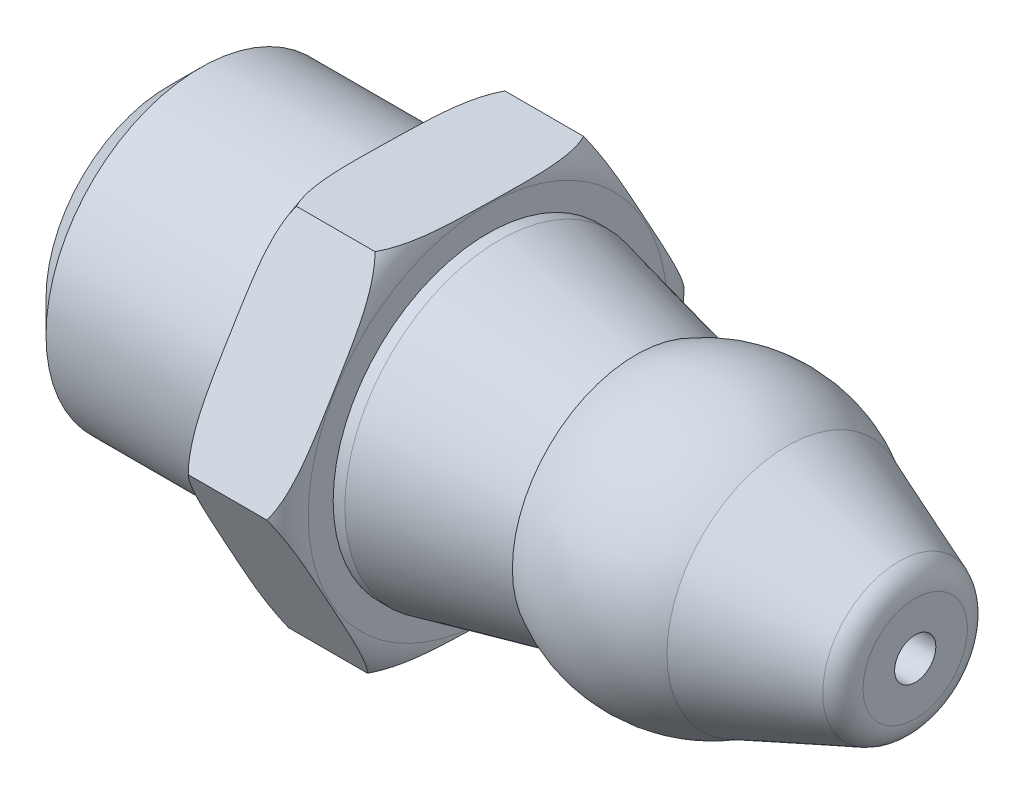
SolidWorks part; units mm, degrees
ref_plane "FACE" through (0, 0, 0) normal (0, 0, 1) x (1, 0, 0)
ref_plane "DESSUS" through (0, 0, 0) normal (0, 1, 0) x (1, 0, 0)
ref_plane "DROITE" through (0, 0, 0) normal (1, 0, 0) x (0, 0, -1)
sketch "Esquisse1" plane through (0, 0, 0) normal (0, 0, 1) x (1, 0, 0)
  line L0 (-14.5, 2.375) -> (-14.5, 0)
  line L1 (-14.5, 0) -> (0, 0)
  line L2 (0, 0) -> (9.8709, 0) construction
  line L7 (-14.5, 2.375) -> (-13.875, 3)
  line L8 (-8.0737, 3) -> (-13.875, 3)
  line L12 (0, 0) -> (0, 1.353)
  line L18 (-2.4883, 2.3311) -> (0, 1.353)
  line L19 (-8.0737, 3) -> (-5.4243, 2.3963)
  arc A6 (-2.4883, 2.3311) -> (-5.4243, 2.3963) centre (-4.0131, -0.1936) ccw
  dimension "D1" = 8.0737
revolve "Base-Révolution" add sketch "Esquisse1" angle 360 about L2
ref_plane "Plan1" through (-8.07, 0, 0) normal (1, 0, 0) x (0, 0, -1)
ref_plane "Plan2" through (-10.3, 0, 0) normal (-1, 0, 0) x (0, 0, 1)
sketch "Hexagon - inscribed1" plane through (-10.3, 0.2447, 0.4635) normal (-1, 0, 0) x (0, 0, 1)
  line L0 (3.5856, -0.159) -> (1.4868, 3.3048)
  line L1 (1.4868, 3.3048) -> (-2.5623, 3.219)
  line L2 (-2.5623, 3.219) -> (-4.5126, -0.3305)
  line L3 (-4.5126, -0.3305) -> (-2.4138, -3.7942)
  line L4 (-2.4138, -3.7942) -> (1.6353, -3.7085)
  line L5 (1.6353, -3.7085) -> (3.5856, -0.159)
  circle A0 centre (-0.4635, -0.2447) radius 4.05 construction
  circle A1 centre (-0.4635, -0.2447) radius 3 construction
  dimension "Outside Diameter" = 8.1
extrude "Boss.-Extru.1" add sketch "Hexagon - inscribed1" against normal blind 2
sketch "Esquisse5" plane through (0, 0, 0) normal (0, 1, 0) x (1, 0, 0)
  line L0 (-8.3, 4.0491) -> (-10.3, 4.0491) construction
  line L1 (-10.3, 4.2826) -> (-9.533, 4.2826)
  line L2 (-10.3, 2.0988) -> (-10.3, 4.0491) construction
  line L3 (-10.3, 3.4833) -> (-10.3, 4.2826)
  line L4 (-9.3, 5.0213) -> (-9.3, 1.4398) construction
  line L5 (-8.3, 3.4833) -> (-8.3, 4.2826)
  line L6 (-9.067, 4.2826) -> (-8.3, 4.2826)
  line L7 (-15.8233, 0) -> (-0.8676, 0) construction
  arc A0 (-10.3, 3.4833) -> (-9.533, 4.2826) centre (-9.5001, 3.4833) cw
  arc A1 (-8.3, 3.4833) -> (-9.067, 4.2826) centre (-9.0999, 3.4833) ccw
revolve "Enlèvement de matière-Révolution1" cut sketch "Esquisse5" angle 360 about L7
sketch "Esquisse6" plane through (0, 0, 0) normal (1, 0, 0) x (0, 0, -1)
  circle A0 centre (0, 0) radius 0.4
  dimension "D1" = 0.8
extrude "Enlèv. mat.-Extru.1" cut sketch "Esquisse6" against normal through all
fillet "Congé2" radius 0.5 1 edges at (0, 0, 1.353)
thread "Filetage1" pitch 1 start angle 0, offset 0, length 5, pitch 1, diameter 6
ref_plane "Plan3" through (-10.3, 0, 3) normal (0, -1, 0) x (0, 0, 1)
sketch "Profil de filetage1" plane through (-10.3, 0, 3) normal (0, -1, 0) x (0, 0, 1)
  line L0 (0, 0) -> (0, 1) construction
  line L11 (0, 0) -> (0, 0.875)
  line L12 (0, 0.875) -> (-0.5413, 0.5625)
  line L13 (-0.5413, 0.5625) -> (-0.5413, 0.3125)
  line L15 (-0.5413, 0.3125) -> (0, 0)
  line L17 (-0.5413, 0.4375) -> (0, 0.4375) construction
  point P2 (0, 0)
  dimension "Pitch" = 1
  dimension "Profile_Angle" = 60
  dimension "Profile_Land" = 0.25
  dimension "Profile_Height" = 0.5413
